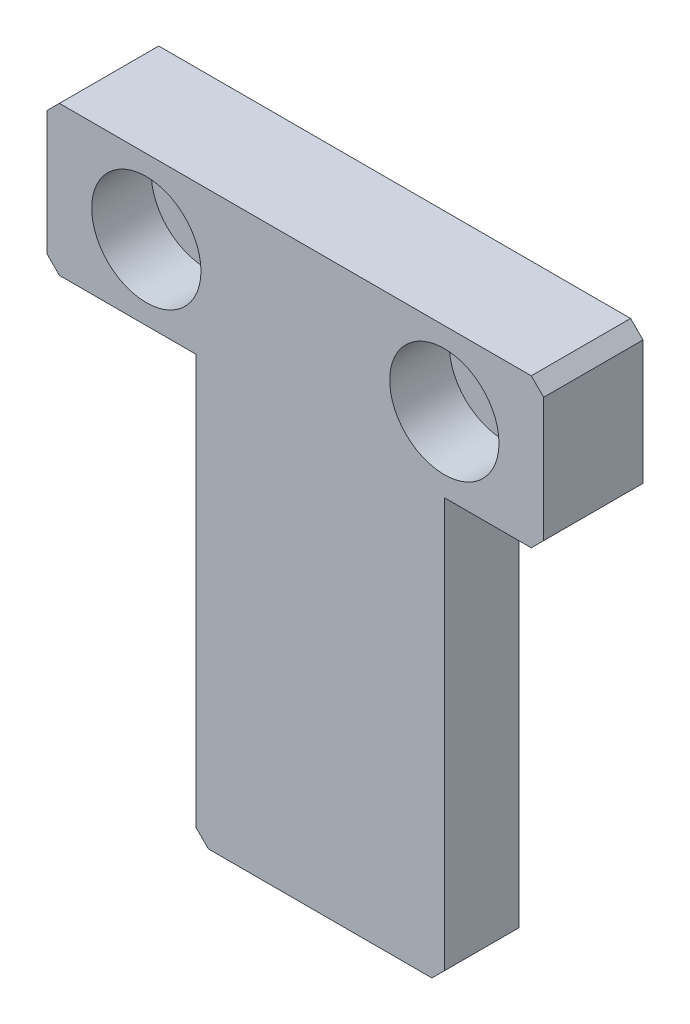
SolidWorks part; units mm, degrees
ref_plane "Plan1" through (0, 0, 0) normal (0, 0, 1) x (1, 0, 0)
ref_plane "Plan2" through (0, 0, 0) normal (0, 1, 0) x (1, 0, 0)
ref_plane "Plan3" through (0, 0, 0) normal (1, 0, 0) x (0, 0, -1)
sketch "Esquisse1" plane through (0, 0, 0) normal (0, 0, 1) x (1, 0, 0)
  line L0 (50, 0) -> (-50, 0) construction
  line L1 (0, 23) -> (20, 23)
  line L2 (0, 23) -> (0, 17)
  line L3 (6, 0) -> (16, 0)
  line L4 (20, 23) -> (20, 17)
  line L5 (0, -50) -> (0, 50) construction
  line L6 (0, 17) -> (6, 17)
  line L7 (6, 17) -> (6, 0)
  line L8 (16, 0) -> (16, 17)
  line L9 (16, 17) -> (20, 17)
  dimension "D1" = 23
  dimension "D2" = 20
  dimension "D3" = 6
  dimension "D4" = 6
  dimension "D5" = 4
extrude "Boss.-Extru.1" add sketch "Esquisse1" along normal blind 4
hole_wizard "Chambrage pour vis à tête hexagonale M21" positions "Esquisse3" profile "Esquisse2" counterbore size "M2" standard "ISO"
sketch "Esquisse3" plane through (0, 0, 4) normal (0, 0, 1) x (1, 0, 0)
  line L0 (20, 23) -> (0, 23) construction
  line L1 (0, 23) -> (0, 17) construction
  line L2 (20, 17) -> (20, 23) construction
  point P0 (4, 20)
  point P2 (16, 20)
  dimension "D1" = 3
  dimension "D2" = 12
  dimension "D3" = 4
  dimension "D4" = 4
sketch "Esquisse2" plane through (4, 20, 4) normal (1, 0, 0) x (0, -1, 0)
  line L0 (0, 0) -> (0, 4)
  line L1 (0, 4) -> (1.2, 4)
  line L3 (1.2, 4) -> (1.2, 2.4)
  line L4 (1.2, 2.4) -> (2.2, 2.4)
  line L5 (2.2, 2.4) -> (2.2, 0)
  line L7 (2.2, 0) -> (0, 0)
  line L11 (0, -6.35) -> (0, 107.95) construction
  dimension "Diamètre du perçage jusqu'au prochain" = 2.4
  dimension "Profondeur du perçage jusqu'au prochain" = 4
  dimension "Diamètre du chambrage" = 4.4
  dimension "Profondeur du chambrage" = 2.4
chamfer "Chanfrein1" distance 0.5 angle 45 6 edges at (16, 0, 2) (20, 17, 2) (6, 0, 2) (20, 23, 2) (0, 17, 2) (0, 23, 2)
sketch "Esquisse4" plane through (0, 0, 0) normal (0, 0, -1) x (-1, 0, 0)
  line L0 (-0.5, 17) -> (-6, 17) construction
  line L1 (-20, 17) -> (0, 17)
  line L2 (-20, 17) -> (-20, 0)
  line L3 (-20, 0) -> (0, 0)
  line L4 (0, 17) -> (0, 0)
  line L5 (-6.5, 0) -> (-15.5, 0) construction
  line L6 (0, 22.5) -> (0, 17.5) construction
  line L7 (-20, 17.5) -> (-20, 22.5) construction
extrude "Enlèv. mat.-Extru.1" cut sketch "Esquisse4" against normal blind 1
